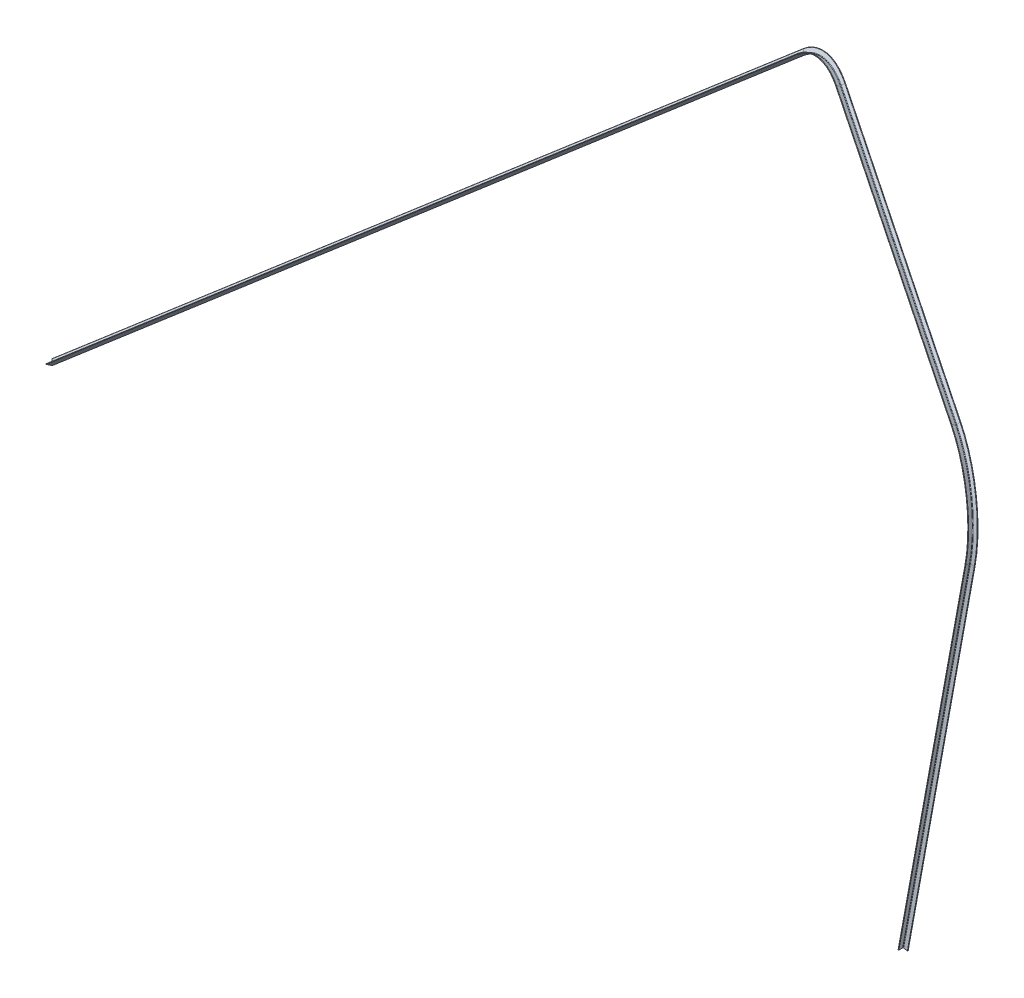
SolidWorks part; units mm, degrees
ref_plane "Ebene vorne" through (0, 0, 0) normal (0, 0, 1) x (1, 0, 0)
ref_plane "Ebene oben" through (0, 0, 0) normal (0, 1, 0) x (1, 0, 0)
ref_plane "Ebene rechts" through (0, 0, 0) normal (1, 0, 0) x (0, 0, -1)
sketch3d "3D-Skizze1"
  line L0 (-18459.2742, -12585.416, -4925.3577) -> (2376.4762, 5508.7458, -3321.2967)
  line L1 (3729.6086, 5692.3703, -2927.9251) -> (9525.0109, 2501.46, -82.9761)
  line L2 (10523.7235, 290.2326, 568.1268) -> (9052.9028, -8847.83, 809.1753)
  arc A0 (2376.4762, 5508.7458, -3321.2967) -> (3729.6086, 5692.3703, -2927.9251) centre (3097.9235, 4634.2485, -2827.9242) ccw
  arc A1 (9525.0109, 2501.46, -82.9761) -> (10523.7235, 290.2326, 568.1268) centre (8579.0016, 580.0579, -310.9299) ccw
  point P3 (3471.6219, 4304.2282, -3959.3322)
  point P7 (9439.0485, 389.7843, -2276.3301)
other "Strukturbauteil1"
ref_plane "Ebene2" through (10523.7235, 290.2326, 568.1268) normal (-0.1589, -0.987, 0.026) x (0.9873, -0.1588, 0.0042)
sketch "Skizze1" plane through (10523.7235, 290.2326, 568.1268) normal (-0.1589, -0.987, 0.026) x (0.9873, -0.1588, 0.0042)
  line L0 (14, 28) -> (14, 123)
  line L1 (130, 0) -> (0, 0)
  line L2 (130, 0) -> (130, 7)
  line L3 (123, 14) -> (28, 14)
  line L4 (0, 0) -> (0, 130)
  line L5 (7, 130) -> (0, 130)
  line L6 (65, 0) -> (65, 130) construction
  arc A0 (28, 14) -> (14, 28) centre (28, 28) cw
  arc A1 (14, 123) -> (7, 130) centre (7, 123) ccw
  arc A2 (123, 14) -> (130, 7) centre (123, 7) cw
  point P4 (0, 65)
  point P5 (65, 0)
  point P14 (130, 14)
  point P15 (0, 0)
  dimension "D4" = 14
  dimension "D5" = 7
  dimension "D1" = 130
  dimension "D2" = 14
  dimension "D3" = 130
equation "\"LÄNGE\"=0"
equation "\"BREITE\"=0"
equation "\"HÖHE\"=0"
equation "\"DURCHMESSER\"=0"
equation "\"Stückzahl\"= 1"
